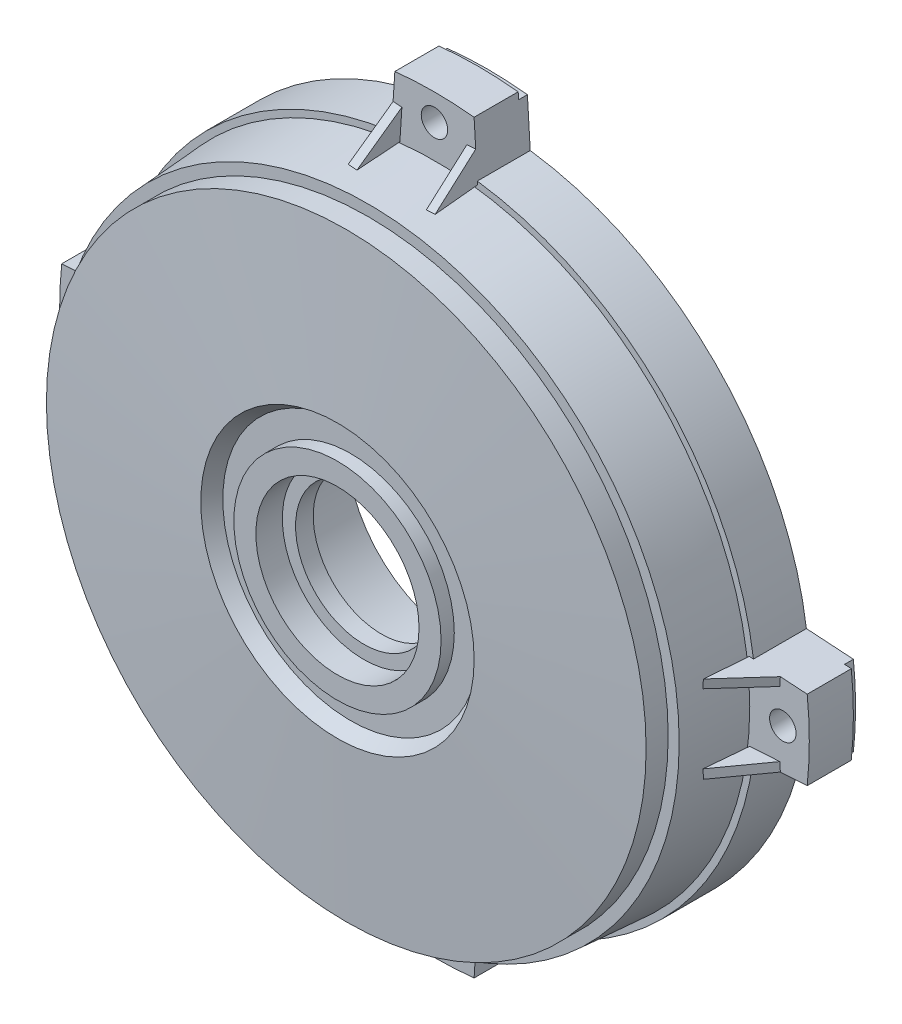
SolidWorks part; units mm, degrees
ref_plane "前视基准面" through (0, 0, 0) normal (0, 0, 1) x (1, 0, 0)
ref_plane "上视基准面" through (0, 0, 0) normal (0, 1, 0) x (1, 0, 0)
ref_plane "右视基准面" through (0, 0, 0) normal (1, 0, 0) x (0, 0, -1)
sketch "草图1" plane through (0, 0, 0) normal (0, 1, 0) x (1, 0, 0)
  line L0 (0, 0) -> (0, 28.0084) construction
  line L1 (15.5, 5.0884) -> (22.5, 5.0884)
  line L2 (22.5, 5.0884) -> (22.5, 6.0884)
  line L3 (22.5, 6.0884) -> (26, 6.0884)
  line L4 (26, 6.0884) -> (26, 23.0884)
  line L5 (26, 23.0884) -> (34, 23.0884)
  line L6 (34, 23.0884) -> (34, 4.0332)
  line L7 (15.5, 5.0884) -> (15.5, 1.0884)
  line L8 (15.5, 1.0884) -> (18.5, 1.0884)
  line L9 (18.5, 1.0884) -> (18.5, -4.9116)
  line L10 (18.5, -4.9116) -> (23.5, -4.9116)
  line L11 (23.5, -4.9116) -> (23.5, -1.9116)
  line L12 (23.5, -1.9116) -> (29, -1.9116)
  line L13 (29, -1.9116) -> (31, -4.9116)
  line L14 (31, -4.9116) -> (68, -2.9116)
  line L15 (68, -2.9116) -> (68, 2.0884)
  line L16 (68, 2.0884) -> (70.5, 2.0884)
  line L17 (70.5, 2.0884) -> (71.5, 17.0884)
  line L18 (71.5, 17.0884) -> (73, 17.0884)
  line L19 (73, 17.0884) -> (73, 29.0884)
  line L20 (73, 29.0884) -> (70, 29.0884)
  line L21 (67.2333, 5.5884) -> (70, 29.0884)
  line L22 (67.2333, 5.5884) -> (64.5, 5.5884)
  line L23 (64.5, 5.5884) -> (64.5, 0.4043)
  line L24 (64.5, 0.4043) -> (39.2699, -0.9595)
  arc A0 (39.2699, -0.9595) -> (34, 4.0332) centre (39, 4.0332) cw
  dimension "D25" = 5
  dimension "D1" = 15.5
  dimension "D2" = 22.5
  dimension "D3" = 26
  dimension "D4" = 1
  dimension "D5" = 17
  dimension "D6" = 34
  dimension "D7" = 18.5
  dimension "D8" = 23.5
  dimension "D9" = 6
  dimension "D10" = 3
  dimension "D11" = 29
  dimension "D12" = 31
  dimension "D13" = 2
  dimension "D14" = 5
  dimension "D15" = 68
  dimension "D16" = 70.5
  dimension "D17" = 71.5
  dimension "D18" = 73
  dimension "D19" = 24
  dimension "D20" = 70
  dimension "D21" = 34
  dimension "D22" = 12
  dimension "D23" = 3.5
  dimension "D24" = 3.5
revolve "旋转1" add sketch "草图1" angle 360 about L0
sketch "草图2" plane through (0, 0, -29.0884) normal (0, 0, -1) x (-1, 0, 0)
  circle A0 centre (0, 0) radius 70
extrude "切除-拉伸1" cut sketch "草图2" against normal blind 4
sketch "草图3" plane through (0, 0, -29.0884) normal (0, 0, -1) x (-1, 0, 0)
  line L0 (-8.9874, 84.5235) -> (-9.9009, 69.2963)
  line L1 (8.9874, 84.5235) -> (9.9745, 69.2857)
  arc A0 (8.9874, 84.5235) -> (-8.9874, 84.5235) centre (0, 0) ccw
  arc A1 (9.9745, 69.2857) -> (-9.9009, 69.2963) centre (0, 0) ccw
extrude "凸台-拉伸1" add sketch "草图3" against normal up to surface (12 mm away)
pattern_circular "阵列(圆周)1" count 4 every 90 about axis through (0, 0, 0) along (0, 0, 1) of "凸台-拉伸1"
sketch "草图4" plane through (0, 0, -29.0884) normal (0, 0, -1) x (-1, 0, 0)
  circle A0 centre (0, 0) radius 83.5
extrude "切除-拉伸2" cut sketch "草图4" against normal blind 2 flip side to cut
sketch "草图5" plane through (0, 0, -29.0884) normal (0, 0, -1) x (-1, 0, 0)
  circle A5 centre (0, 79) radius 3
  circle A6 centre (79, 0) radius 3
  circle A7 centre (0, -79) radius 3
  circle A8 centre (-79, 0) radius 3
  point P15 (0, 0)
  dimension "D1" = 4
extrude "切除-拉伸3" cut sketch "草图5" against normal through all
sketch "草图6" plane through (0, 0, 0) normal (0, 1, 0) x (1, 0, 0)
  line L0 (-64.5464, 0.4252) -> (-33.2767, -1.4057)
ref_plane "基准面1" through (-64.5464, 0, -0.4252) normal (0.9983, 0, 0.0585) x (0.0585, 0, -0.9983)
sketch "草图7" plane through (-64.5464, 0, -0.4252) normal (0.9983, 0, 0.0585) x (0.0585, 0, -0.9983)
  line L5 (-0.0934, 2) -> (-0.0934, -2)
  line L6 (-0.0934, 2) -> (2.9066, 2)
  line L7 (2.9066, 2) -> (2.9066, -2)
  line L8 (2.9066, -2) -> (-0.0934, -2)
sweep "扫描1" add profiles "草图7" path "草图6"
pattern_circular "阵列(圆周)3" count 8 over 360 about axis through (0, 0, 0) along (0, 0, 1) of "扫描1"
sketch "草图8" plane through (0, 0, -23.0884) normal (0, 0, -1) x (-1, 0, 0)
  circle A1 centre (0, 31) radius 5
extrude "凸台-拉伸2" add sketch "草图8" against normal blind 22
pattern_circular "阵列(圆周)4" count 3 over 360 about axis through (0, 0, 0) along (0, 0, 1) of "凸台-拉伸2"
sketch "草图9" plane through (0, 0, -23.0884) normal (0, 0, -1) x (-1, 0, 0)
  circle A1 centre (0, 31) radius 2.05
extrude "切除-拉伸4" cut sketch "草图9" against normal blind 2.05 draft 45
pattern_circular "阵列(圆周)5" count 3 over 360 about axis through (0, 0, 0) along (0, 0, 1) of "切除-拉伸4"
sketch "草图10" plane through (14.0078, 0.8404, 0) normal (0.9982, 0.0599, 0) x (0, 0, -1)
  line L0 (17.0884, 77.7361) -> (7.4141, 69.9718)
  line L1 (17.0884, 83.8336) -> (17.0884, 71.6385) construction
  line L2 (7.4141, 69.9718) -> (17.0884, 70.9025)
  line L3 (17.0884, 70.9025) -> (17.0884, 77.7361)
extrude "凸台-拉伸3" add sketch "草图10" against normal blind 2
pattern_circular "阵列(圆周)7" count 4 over 360 about axis through (0, 0, 0) along (0, 0, 1) of "凸台-拉伸3"
sketch "草图11" plane through (-14.4022, 0.933, 0) normal (-0.9979, 0.0646, 0) x (0, 0, 1)
  line L7 (-17.0884, 77.6624) -> (-17.0884, 70.6214)
  line L8 (-17.0884, 71.5591) -> (-17.0884, 83.7658) construction
  line L10 (-7.4085, 69.8803) -> (-17.0884, 77.6624)
  line L11 (-17.0884, 70.6214) -> (-7.4085, 69.8803)
extrude "凸台-拉伸4" add sketch "草图11" against normal blind 2
pattern_circular "阵列(圆周)12" count 4 over 360 about axis through (0, 0, 0) along (0, 0, 1) of "凸台-拉伸4"
